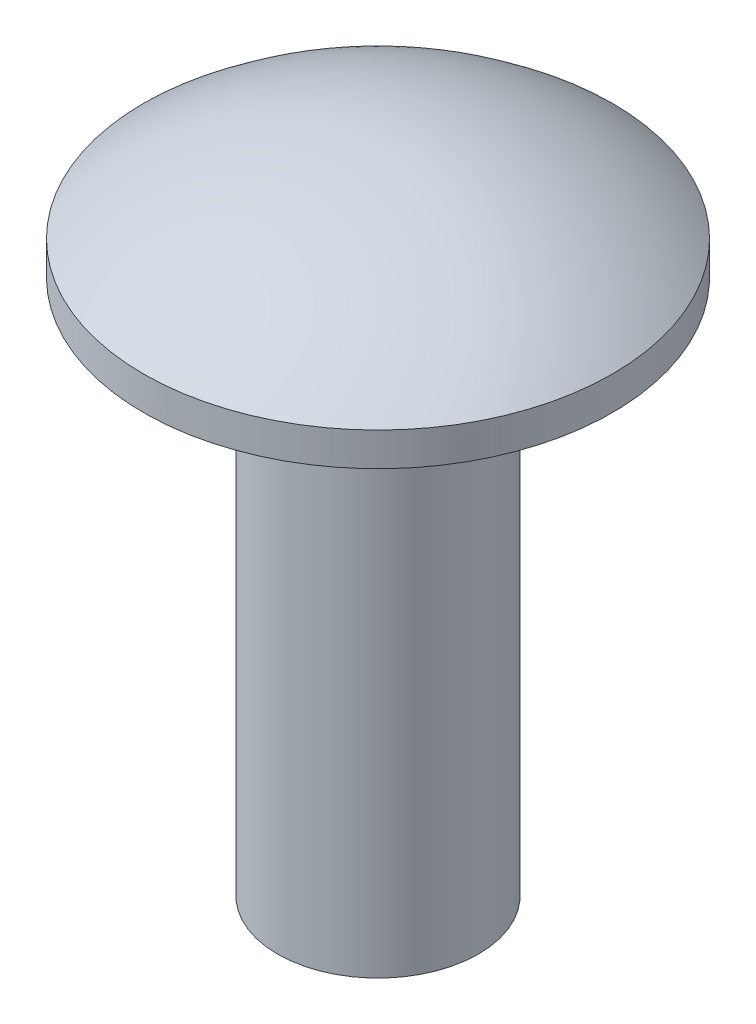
SolidWorks part; units mm, degrees
ref_plane "Plan1" through (0, 0, 0) normal (0, 0, 1) x (1, 0, 0)
ref_plane "Plan2" through (0, 0, 0) normal (0, 1, 0) x (1, 0, 0)
ref_plane "Plan3" through (0, 0, 0) normal (1, 0, 0) x (0, 0, -1)
sketch "Esquisse1" plane through (0, 0, 0) normal (0, 0, 1) x (1, 0, 0)
  line L0 (0, 10) -> (0, 0) construction
  line L1 (3.05, 0) -> (-3.05, 0)
  line L2 (0, 0) -> (0, 20) construction
  line L6 (3.05, 0) -> (3.05, 1.4)
  line L7 (3.05, 1.4) -> (-3.05, 1.4)
  line L8 (-3.05, 0) -> (-3.05, 1.4)
  dimension "D1" = 6.1
  dimension "D2" = 1.4
extrude "Base-Extrusion" add sketch "Esquisse1" along normal mid plane 6.1
sketch "Esquisse2" plane through (0, 0, 0) normal (0, 0, 1) x (1, 0, 0)
  line L0 (0, 13.6764) -> (0, 0) construction
  line L1 (0, 1.4) -> (7, 1.4)
  line L2 (0, 4.9) -> (0, 1.4)
  line L3 (3.05, 1.4) -> (-3.05, 1.4) construction
  line L4 (7, 1.4) -> (7, 2.4)
  arc A0 (7, 2.4) -> (0, 4.9) centre (0, -6.15) ccw
  dimension "D1" = 1
  dimension "D3" = 14
  dimension "D2" = 3.5
  dimension "D4" = 13.6764
revolve "Boss.-Révol.1" add sketch "Esquisse2" angle 360 about L0
sketch "Esquisse3" plane through (0, 1.4, 0) normal (0, -1, 0) x (1, 0, 0)
  circle A0 centre (0, 0) radius 3
  dimension "D1" = 6
extrude "Boss.-Extru.1" add sketch "Esquisse3" along normal blind 16
